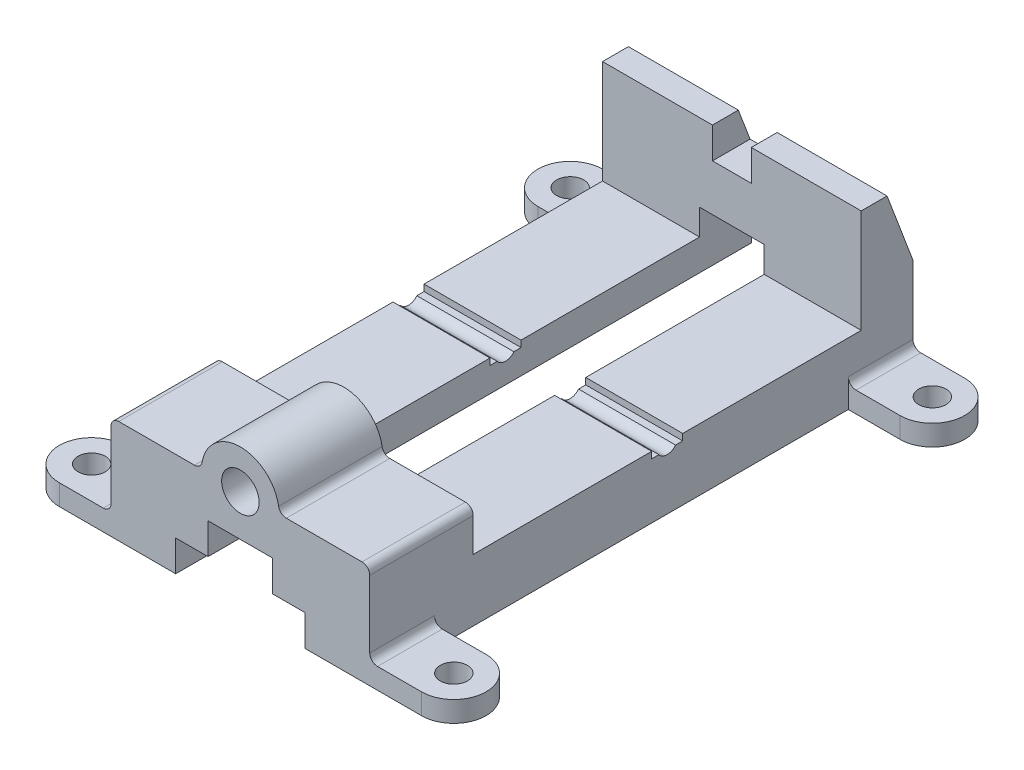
SolidWorks part; units mm, degrees
ref_plane "Front Plane" through (0, 0, 0) normal (0, 0, 1) x (1, 0, 0)
ref_plane "Top Plane" through (0, 0, 0) normal (0, 1, 0) x (1, 0, 0)
ref_plane "Right Plane" through (0, 0, 0) normal (1, 0, 0) x (0, 0, -1)
sketch "Sketch1" plane through (0, 0, 0) normal (0, 0, 1) x (1, 0, 0)
  line L0 (0, 0) -> (0, 72.5365) construction
  line L1 (-25, 0) -> (-50, 0)
  line L2 (25, 0) -> (50, 0)
  line L3 (-50, 0) -> (-50, 40)
  line L4 (50, 0) -> (50, 40)
  line L5 (-50, 40) -> (-15, 40)
  line L6 (50, 40) -> (15, 40)
  line L7 (-25, 0) -> (-25, 12)
  line L8 (25, 0) -> (25, 12)
  line L9 (-25, 12) -> (-12.5, 12)
  line L10 (25, 12) -> (12.5, 12)
  line L11 (-12.5, 12) -> (-12.5, 24)
  line L12 (12.5, 12) -> (12.5, 24)
  line L13 (-12.5, 24) -> (12.5, 24)
  arc A0 (-15, 40) -> (15, 40) centre (0, 40) cw
  point P17 (0, 24)
  point P18 (0, 24)
  dimension "D7" = 15
  dimension "D1" = 100
  dimension "D2" = 50
  dimension "D3" = 12
  dimension "D4" = 24
  dimension "D5" = 25
  dimension "D6" = 40
extrude "Extrude1" add sketch "Sketch1" against normal blind 210
sketch "Sketch2" plane through (50, 0, 0) normal (1, 0, 0) x (0, 0, -1)
  line L1 (40, 24) -> (190, 24)
  line L2 (40, 24) -> (40, 55)
  line L3 (40, 55) -> (190, 55)
  line L4 (190, 24) -> (190, 55)
  line L5 (210, 55) -> (0, 55) construction
  line L7 (0, 0) -> (0, 40) construction
  line L8 (210, 0) -> (210, 40) construction
  line L9 (210, 24) -> (0, 24) construction
  dimension "D2" = 20
  dimension "D3" = 40
extrude "Cut-Extrude1" cut sketch "Sketch2" against normal up to next
sketch "Sketch4" plane through (0, 0, -190) normal (0, 0, 1) x (1, 0, 0)
  line L1 (-50, 24) -> (50, 24)
  line L2 (-50, 24) -> (-50, 64)
  line L3 (-50, 64) -> (50, 64)
  line L4 (50, 24) -> (50, 64)
  dimension "D1" = 40
extrude "Extrude2" add sketch "Sketch4" against normal up to vertex (20 mm away)
sketch "Sketch5" plane through (0, 0, -190) normal (0, 0, 1) x (1, 0, 0)
  line L1 (-12.5, 24) -> (12.5, 24)
  line L2 (-12.5, 24) -> (-12.5, 34)
  line L3 (-12.5, 34) -> (12.5, 34)
  line L4 (12.5, 24) -> (12.5, 34)
  dimension "D1" = 10
extrude "Cut-Extrude2" cut sketch "Sketch5" against normal up to next
hole_wizard "M16x1.5 Tapped Hole1" positions "Sketch7" profile "Sketch6" tap size "M16x1.5" standard "Ansi Metric"
sketch "Sketch7" plane through (0, 0, 0) normal (0, 0, 1) x (1, 0, 0)
  point P0 (0, 40)
sketch "Sketch6" plane through (0, 40, 0) normal (1, 0, 0) x (0, -1, 0)
  line L0 (0, 0) -> (0, 40)
  line L1 (0, 40) -> (7.25, 40)
  line L2 (7.25, 40) -> (7.25, 0)
  line L5 (7.25, 0) -> (0, 0)
  line L11 (0, -6.35) -> (0, 107.95) construction
  dimension "Thru Tap Drill Dia." = 14.5
  dimension "Thru Tap Drill Depth" = 40
sketch "Sketch8" plane through (0, 0, 0) normal (0, 1, 0) x (1, 0, 0)
  line L0 (50, 0) -> (70, 0)
  line L1 (70, 25) -> (50, 25)
  line L2 (50, 40) -> (50, 0) construction
  line L3 (50, 25) -> (50, 0)
  line L4 (0, 210) -> (0, 0) construction
  line L6 (0, 105) -> (101.5827, 105) construction
  line L7 (50, 185) -> (50, 210)
  line L8 (70, 185) -> (50, 185)
  line L9 (50, 210) -> (70, 210)
  line L10 (-50, 25) -> (-50, 0)
  line L11 (-70, 25) -> (-50, 25)
  line L12 (-50, 0) -> (-70, 0)
  line L13 (-50, 210) -> (-70, 210)
  line L14 (-70, 185) -> (-50, 185)
  line L15 (-50, 185) -> (-50, 210)
  line L16 (50, 210) -> (-50, 210) construction
  arc A0 (70, 0) -> (70, 25) centre (70, 12.5) ccw
  arc A1 (70, 210) -> (70, 185) centre (70, 197.5) cw
  arc A2 (-70, 0) -> (-70, 25) centre (-70, 12.5) cw
  arc A3 (-70, 210) -> (-70, 185) centre (-70, 197.5) ccw
  dimension "D1" = 25
  dimension "D3" = 20
extrude "Extrude3" add sketch "Sketch8" along normal blind 8
hole_wizard "M12x1.5 Tapped Hole1" positions "Sketch10" profile "Sketch9" tap size "M12x1.5" standard "Ansi Metric"
sketch "Sketch10" plane through (0, 8, 0) normal (0, 1, 0) x (-1, 0, 0)
  point P0 (-70, -12.5)
  point P4 (-70, -197.5)
  point P7 (70, -197.5)
  point P10 (70, -12.5)
sketch "Sketch9" plane through (70, 8, -12.5) normal (1, 0, 0) x (0, 0, 1)
  line L0 (0, 0) -> (0, 8)
  line L1 (0, 8) -> (5.25, 8)
  line L2 (5.25, 8) -> (5.25, 0)
  line L5 (5.25, 0) -> (0, 0)
  line L11 (0, -6.35) -> (0, 107.95) construction
  dimension "Thru Tap Drill Dia." = 10.5
  dimension "Thru Tap Drill Depth" = 8
fillet "Fillet2" radius 3 8 edges at (-50, 8, -197.5) (-15, 40, -20) (15, 40, -20) (50, 8, -197.5) (50, 40, -20) (-50, 40, -20)
sketch "Sketch11" plane through (50, 0, 0) normal (1, 0, 0) x (0, 0, -1)
  line L0 (40, 24) -> (190, 24) construction
  line L1 (118.2261, 21.5) -> (121, 21.5)
  line L2 (121, 21.5) -> (121, 24)
  line L3 (115, 29.1221) -> (115, 18.4847) construction
  line L4 (115, 24) -> (123.9027, 24) construction
  line L5 (109, 21.5) -> (109, 24)
  line L6 (111.7739, 21.5) -> (109, 21.5)
  line L7 (109, 24) -> (121, 24)
  arc A0 (111.7739, 21.5) -> (118.2261, 21.5) centre (115, 24) ccw
  dimension "D3" = 4.0814
  dimension "D1" = 6
  dimension "D2" = 2.5
extrude "Cut-Extrude3" cut sketch "Sketch11" against normal through all
sketch "Sketch12" plane through (50, 0, 0) normal (1, 0, 0) x (0, 0, -1)
  line L0 (200, 64) -> (210, 37.5)
  line L1 (210, 64) -> (190, 64) construction
  line L2 (210, 11) -> (210, 64) construction
  line L3 (200, 64) -> (210, 64)
  line L4 (210, 64) -> (210, 37.5)
extrude "Cut-Extrude4" cut sketch "Sketch12" against normal through all
sketch "Sketch14" plane through (0, 64, 0) normal (0, 1, 0) x (-1, 0, 0)
  line L0 (0, -200) -> (0, -190) construction
  line L1 (50, -200) -> (-50, -200) construction
  line L2 (-50, -190) -> (50, -190) construction
  line L3 (50, -210) -> (-50, -210) construction
  line L4 (7.5, -210) -> (7.5, -190)
  line L5 (7.5, -190) -> (-7.5, -190)
  line L6 (-7.5, -210) -> (-7.5, -190)
  line L7 (-7.5, -210) -> (7.5, -210)
  dimension "D1" = 7.5
extrude "Cut-Extrude6" cut sketch "Sketch14" against normal blind 12
